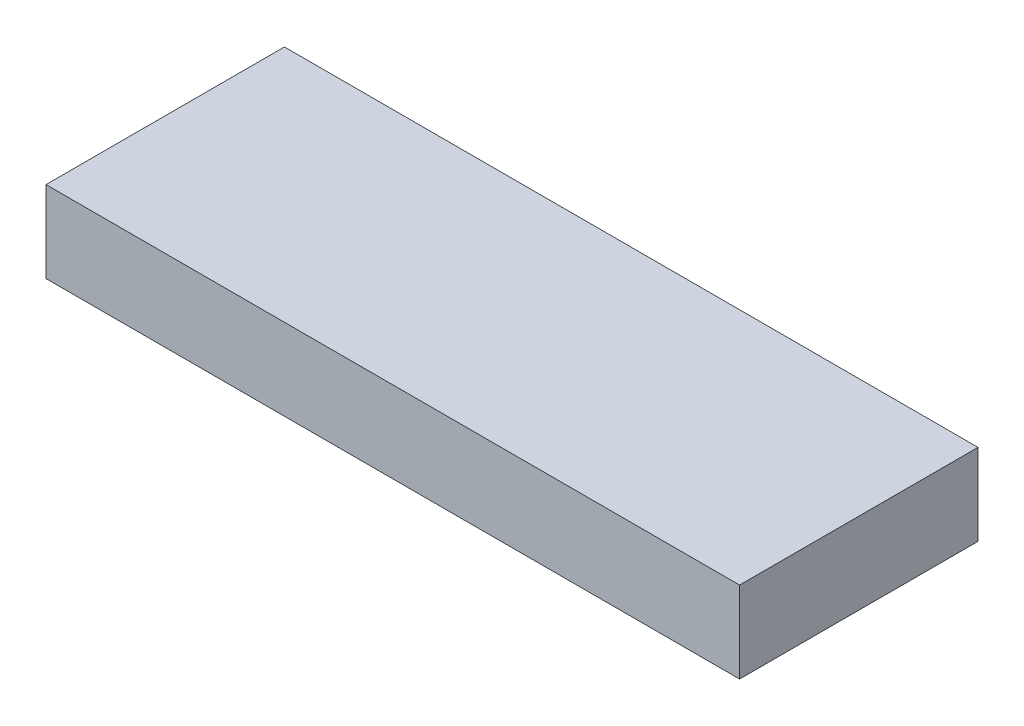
SolidWorks part; units mm, degrees
ref_plane "Front Plane" through (0, 0, 0) normal (0, 0, 1) x (1, 0, 0)
ref_plane "Top Plane" through (0, 0, 0) normal (0, 1, 0) x (1, 0, 0)
ref_plane "Right Plane" through (0, 0, 0) normal (1, 0, 0) x (0, 0, -1)
sketch "Sketch1" plane through (0, 0, 0) normal (0, 1, 0) x (1, 0, 0)
  line L1 (-812.8, 279.4) -> (812.8, 279.4)
  line L2 (-812.8, 279.4) -> (-812.8, -279.4)
  line L3 (-812.8, -279.4) -> (812.8, -279.4)
  line L4 (812.8, 279.4) -> (812.8, -279.4)
  line L5 (-812.8, 279.4) -> (812.8, -279.4) construction
  line L6 (-812.8, -279.4) -> (812.8, 279.4) construction
  point P0 (0, 0)
  dimension "D1" = 558.8
  dimension "D2" = 1625.6
extrude "Boss-Extrude1" add sketch "Sketch1" along normal blind 190.834
